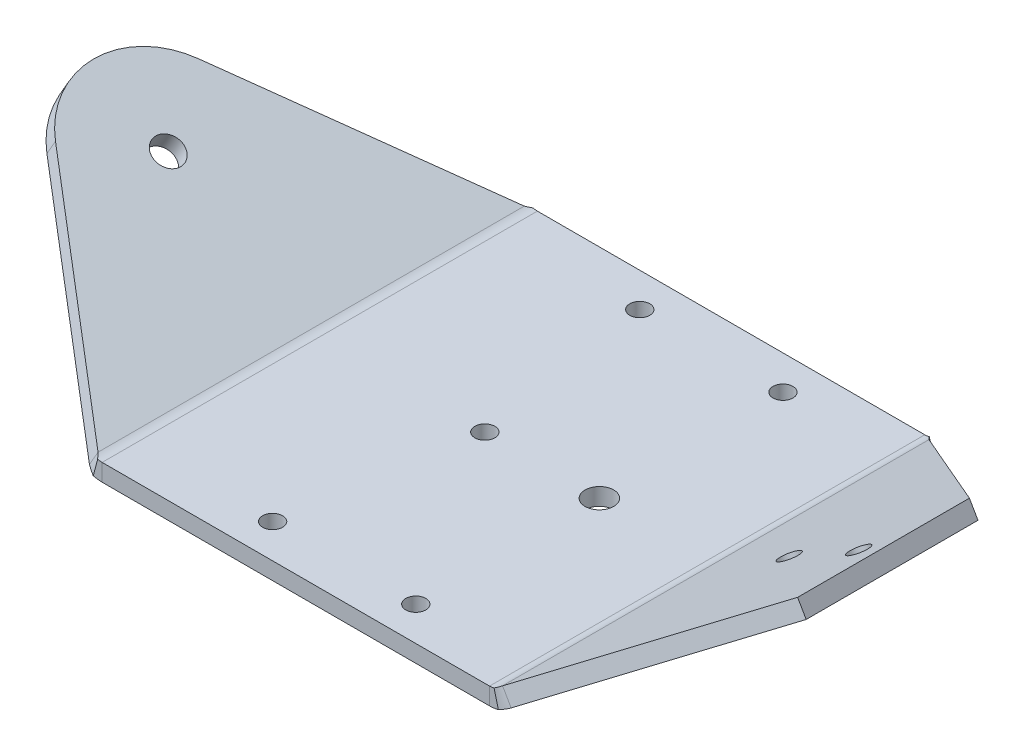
SolidWorks part; units mm, degrees
ref_plane "Front" through (0, 0, 0) normal (0, 0, 1) x (1, 0, 0)
ref_plane "Top" through (0, 0, 0) normal (0, 1, 0) x (1, 0, 0)
ref_plane "Right" through (0, 0, 0) normal (1, 0, 0) x (0, 0, -1)
sketch "Sketch1" plane through (0, 0, 0) normal (0, 1, 0) x (1, 0, 0)
  line L1 (29.9999, -38.0001) -> (-8.3143, -12.4849)
  line L2 (134.9999, -15.0001) -> (99.9999, -38.0001)
  line L3 (29.9999, 38.0001) -> (99.9999, 38.0001)
  line L4 (29.9999, -38.0001) -> (99.9999, -38.0001)
  line L5 (134.9999, -15.0001) -> (134.9999, 15.0001)
  line L9 (134.9999, 15.0001) -> (99.9999, 38.0001)
  line L10 (29.9999, 38.0001) -> (-8.3143, 12.4849)
  circle A0 centre (0, 0) radius 2.5
  arc A1 (-8.3143, 12.4849) -> (-8.3143, -12.4849) centre (0, 0) ccw
  circle A2 centre (54.9999, 32.055) radius 1.75
  circle A3 centre (79.9999, 32.055) radius 1.75
  circle A4 centre (79.9999, 0) radius 2.5
  circle A5 centre (59.9999, 0) radius 1.75
  circle A6 centre (129.9999, 0) radius 1.75
  circle A7 centre (115.9999, 0) radius 1.75
  circle A8 centre (54.9999, -32.055) radius 1.75
  circle A9 centre (79.9999, -32.055) radius 1.75
sheet metal parameters "Sheet-Metal2" thickness 3 parameters "D1"=3
base flange "Base-Flange1" sketch "Sketch1" thickness 3 reverse thickness direction yes parameters "D1"=3
sketch "Sketch8" plane through (0, 3, 0) normal (0, 1, 0) x (-1, 0, 0)
  line L0 (-29.9999, 38.0001) -> (-29.9999, -38.0001)
  line L1 (-99.9999, -38.0001) -> (-99.9999, 38.0001)
sketched bend "Sketched Bend1" parameters "D1"=0
bend "SketchBend1" bend radius 3 bend angle 30 parameters "D5"=1
bend "SketchBend2" bend radius 0 bend angle 30 parameters "D5"=2
flat pattern "Flat-Pattern2"
sketch "Bend-Lines2" plane through (0, 3, 0) normal (0, 1, 0) x (-1, 0, 0)
  line L0 (-99.9999, 38.0001) -> (-99.9999, -38.0001) construction
  line L1 (-29.9999, -38.0001) -> (-29.9999, 38.0001) construction
bend of the flat pattern "Flatten-<SketchBend1>1"
bend of the flat pattern "Flatten-<SketchBend2>1"
